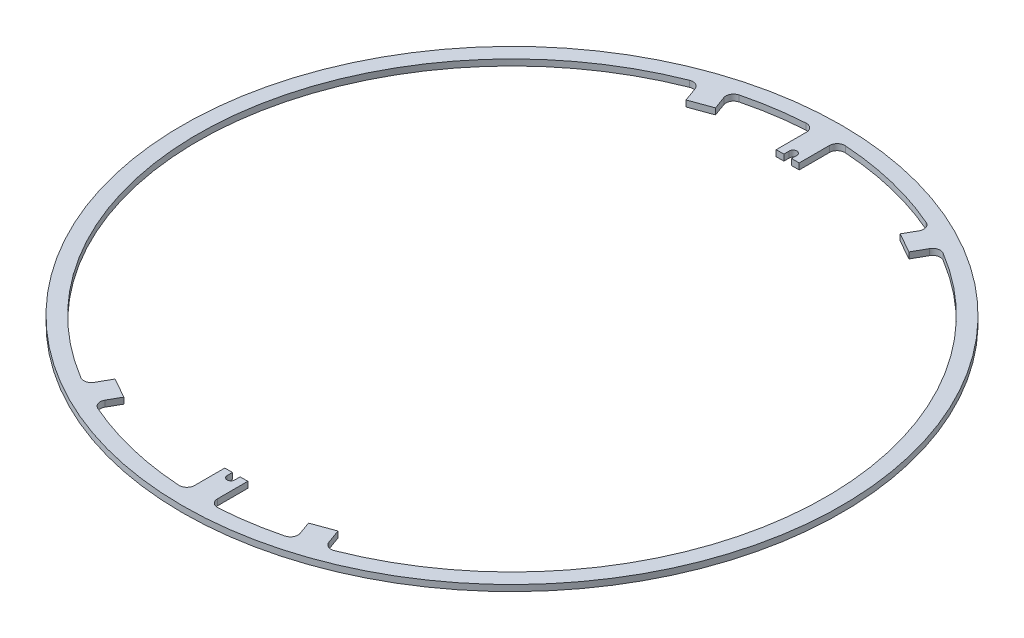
SolidWorks part; units mm, degrees
ref_plane "前视基准面" through (0, 0, 0) normal (0, 0, 1) x (1, 0, 0)
ref_plane "上视基准面" through (0, 0, 0) normal (0, 1, 0) x (1, 0, 0)
ref_plane "右视基准面" through (0, 0, 0) normal (1, 0, 0) x (0, 0, -1)
sketch "草图1" plane through (0, 0, 0) normal (0, 1, 0) x (1, 0, 0)
  circle A0 centre (0, 0) radius 43
  circle A1 centre (0, 0) radius 41
  circle A2 centre (0, 0) radius 35 construction
  dimension "D1" = 86
  dimension "D2" = 2
  dimension "D3" = 70
extrude "凸台-拉伸1" add sketch "草图1" along normal blind 0.8
sketch "草图2" plane through (0, 0.8, 0) normal (0, 1, 0) x (1, 0, 0)
  line L0 (0, 0) -> (0, 47.3857) construction
  line L1 (-1.5, 40.9726) -> (-1.5, 35.9726)
  line L2 (-1.5, 35.9726) -> (1.5, 35.9726)
  line L3 (1.5, 40.9726) -> (1.5, 35.9726)
  line L4 (0, 0) -> (51.4644, 0) construction
  line L5 (1.5, -40.9726) -> (1.5, -35.9726)
  line L6 (-1.5, -40.9726) -> (-1.5, -35.9726)
  line L7 (-1.5, -35.9726) -> (1.5, -35.9726)
  circle A0 centre (0, 0) radius 41 construction
  circle A1 centre (0, 0) radius 41
  point P10 (0, 35.9726)
  dimension "D1" = 5
  dimension "D2" = 3
extrude "凸台-拉伸2" add sketch "草图2" against normal up to surface (0.8 mm away) contours L7 L6 L5 M8 | L3 L1 L2 M8
fillet "圆角1" radius 1 2 edges at (1.5, 0.4, -40.9726) (-1.5, 0.4, -40.9726)
fillet "圆角2" radius 1 2 edges at (1.5, 0.4, 40.9726) (-1.5, 0.4, 40.9726)
sketch "草图3" plane through (0, 0, 0) normal (0, -1, 0) x (1, 0, 0)
  line L0 (0, 36.6726) -> (0, 35.9726) construction
  line L1 (1.5, 35.9726) -> (-1.5, 35.9726) construction
  line L2 (-0.5, 36.6726) -> (-0.5, 33.6726)
  line L3 (-0.5, 33.6726) -> (0.5, 33.6726)
  line L4 (0.5, 33.6726) -> (0.5, 36.6726)
  line L5 (0, 0) -> (11.294, 0) construction
  line L6 (0, -36.6726) -> (0, -35.9726) construction
  line L7 (0.5, -33.6726) -> (0.5, -36.6726)
  line L8 (-0.5, -33.6726) -> (0.5, -33.6726)
  line L9 (-0.5, -36.6726) -> (-0.5, -33.6726)
  arc A0 (0.5, 36.6726) -> (-0.5, 36.6726) centre (0, 36.6726) ccw
  arc A1 (0.5, -36.6726) -> (-0.5, -36.6726) centre (0, -36.6726) cw
  dimension "D1" = 1
  dimension "D2" = 3
  dimension "D3" = 0.7
extrude "切除-拉伸1" cut sketch "草图3" against normal through all
sketch "草图4" plane through (0, 0.8, 0) normal (0, 1, 0) x (1, 0, 0)
  line L0 (0, 0) -> (-20.1894, -35.6846) construction
  line L1 (0, 0) -> (0, -48.4381) construction
  line L2 (-20.1894, -35.6846) -> (-18.7121, -33.0735)
  line L3 (-18.7121, -33.0735) -> (-16.101, -34.5508)
  line L4 (-16.101, -34.5508) -> (-17.5242, -37.0662)
  line L5 (20.1894, 35.6846) -> (18.7121, 33.0735)
  line L6 (18.7121, 33.0735) -> (16.101, 34.5508)
  line L7 (16.101, 34.5508) -> (17.5242, 37.0662)
  arc A0 (-2.5625, 40.9198) -> (-2.5625, -40.9198) centre (0, 0) ccw construction
  arc A1 (-20.1894, -35.6846) -> (-17.5242, -37.0662) centre (0, 0) ccw
  arc A2 (20.1894, 35.6846) -> (17.5242, 37.0662) centre (0, 0) ccw
  point P16 (0, 0)
  dimension "D1" = 3
  dimension "D2" = 3
  dimension "D4" = 29.5
  dimension "D3" = 2
extrude "凸台-拉伸3" add sketch "草图4" against normal up to surface (0.8 mm away)
fillet "圆角3" radius 1 4 edges at (20.1894, 0.4, -35.6846) (17.5242, 0.4, -37.0662) (-17.5242, 0.4, 37.0662) (-20.1894, 0.4, 35.6846)
sketch "草图5" plane through (0, 0, 0) normal (0, -1, 0) x (1, 0, 0)
  line L0 (0, 0) -> (-18.7121, 33.0735) construction
  line L1 (0, 0) -> (14.0228, 38.5274) construction
  line L2 (14.0228, 38.5274) -> (12.9968, 35.7083)
  line L3 (12.9968, 35.7083) -> (10.1777, 36.7344)
  line L4 (10.1777, 36.7344) -> (11.1662, 39.4502)
  line L5 (-12.9968, -35.7083) -> (-10.1777, -36.7344)
  line L6 (-10.1777, -36.7344) -> (-11.1662, -39.4502)
  line L7 (-14.0228, -38.5274) -> (-12.9968, -35.7083)
  arc A0 (21.0752, -35.1687) -> (2.5625, 40.9198) centre (0, 0) ccw construction
  arc A1 (14.0228, 38.5274) -> (11.1662, 39.4502) centre (0, 0) ccw
  arc A2 (-14.0228, -38.5274) -> (-11.1662, -39.4502) centre (0, 0) ccw
  point P17 (0, 0)
  dimension "D1" = 49.5
  dimension "D2" = 3
  dimension "D3" = 3
  dimension "D4" = 2
extrude "凸台-拉伸4" add sketch "草图5" against normal up to surface (0.8 mm away)
fillet "圆角4" radius 1 4 edges at (-11.1662, 0.4, -39.4502) (-14.0228, 0.4, -38.5274) (11.1662, 0.4, 39.4502) (14.0228, 0.4, 38.5274)
